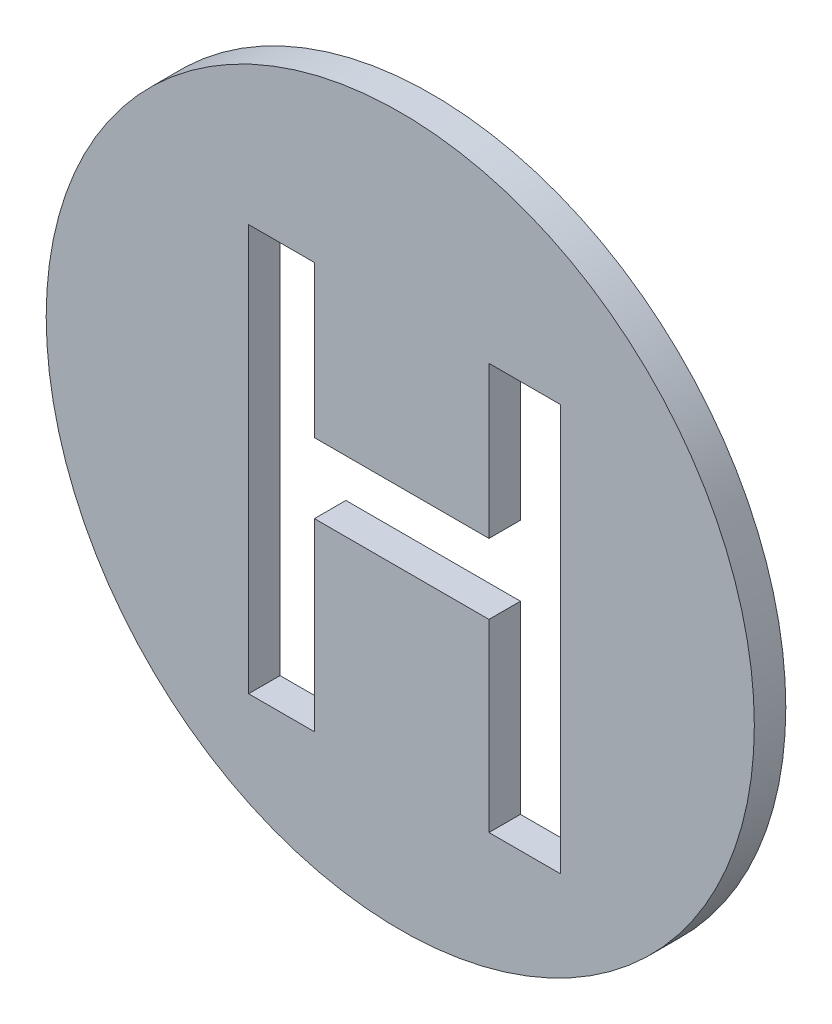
SolidWorks part; units mm, degrees
ref_plane "Front Plane" through (0, 0, 0) normal (0, 0, 1) x (1, 0, 0)
ref_plane "Top Plane" through (0, 0, 0) normal (0, 1, 0) x (1, 0, 0)
ref_plane "Right Plane" through (0, 0, 0) normal (1, 0, 0) x (0, 0, -1)
sketch "Sketch1" plane through (0, 0, 0) normal (0, 0, 1) x (1, 0, 0)
  circle A0 centre (0, 0) radius 45
  dimension "D1" = 90
extrude "Boss-Extrude1" add sketch "Sketch1" along normal blind 4
sketch "Sketch2" plane through (0, 0, 4) normal (0, 0, 1) x (1, 0, 0)
  line L0 (-19.2755, 23.0033) -> (-19.2755, -28.6405)
  line L1 (-19.2755, -28.6405) -> (-10.9106, -28.6405)
  line L2 (-10.9106, -28.6405) -> (-10.9106, -5.1826)
  line L3 (-10.9106, -5.1826) -> (11.2743, -5.1826)
  line L4 (11.2743, -5.1826) -> (11.2743, -28.6405)
  line L5 (11.2743, -28.6405) -> (20.3665, -28.6405)
  line L6 (20.3665, -28.6405) -> (20.3665, 23.0033)
  line L7 (20.3665, 23.0033) -> (11.2743, 23.0033)
  line L8 (11.2743, 23.0033) -> (11.2743, 3.7278)
  line L9 (11.2743, 3.7278) -> (-10.9106, 3.7278)
  line L10 (-10.9106, 3.7278) -> (-10.9106, 23.0033)
  line L11 (-10.9106, 23.0033) -> (-19.2755, 23.0033)
extrude "Cut-Extrude1" cut sketch "Sketch2" against normal blind 4
